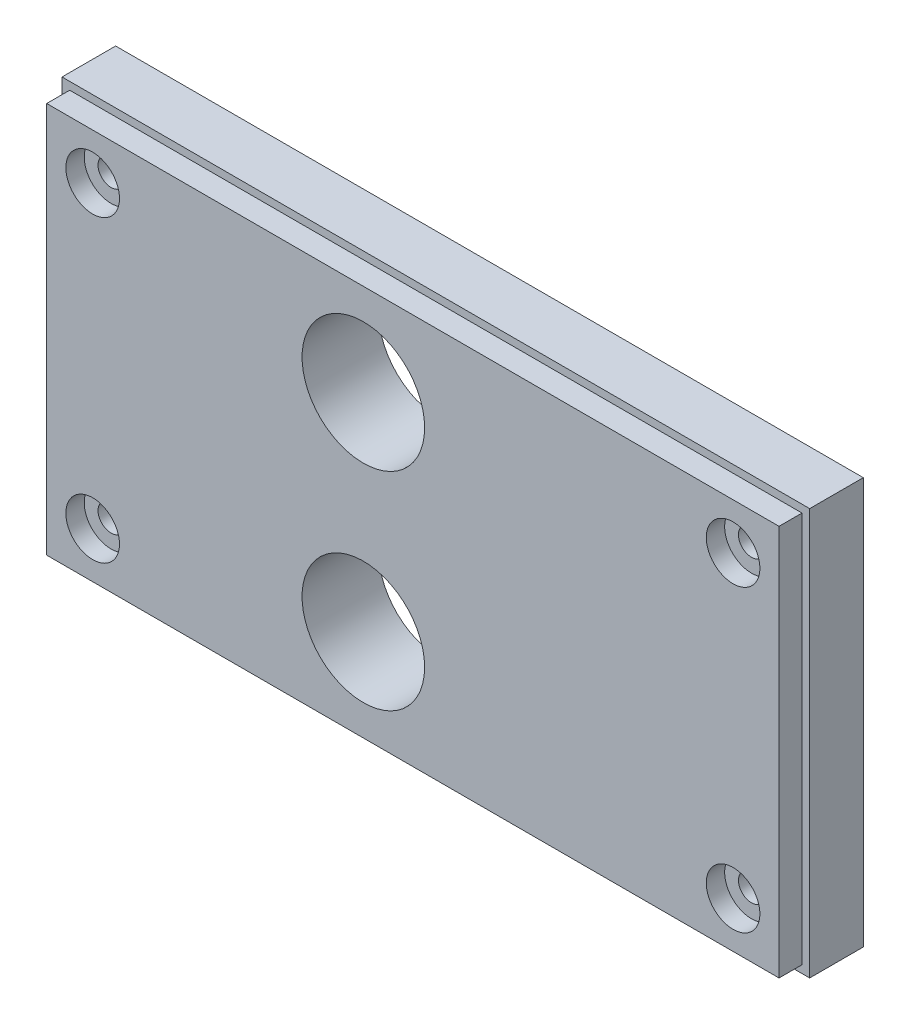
SolidWorks part; units mm, degrees
ref_plane "Płaszczyzna przednia" through (0, 0, 0) normal (0, 0, 1) x (1, 0, 0)
ref_plane "Płaszczyzna górna" through (0, 0, 0) normal (0, 1, 0) x (1, 0, 0)
ref_plane "Płaszczyzna prawa" through (0, 0, 0) normal (1, 0, 0) x (0, 0, -1)
sketch "Szkic1" plane through (0, 0, 0) normal (0, 0, 1) x (1, 0, 0)
  line L1 (130, -76.5359) -> (32.3904, -76.5359)
  line L2 (130, -76.5359) -> (130, -23.4641)
  line L3 (130, -23.4641) -> (32.3904, -23.4641)
  line L4 (32.3904, -76.5359) -> (32.3904, -23.4641)
  line L5 (130, -76.5359) -> (32.3904, -23.4641) construction
  line L6 (130, -23.4641) -> (32.3904, -76.5359) construction
  point P4 (81.1952, -50)
  dimension "D5" = 53.0718
extrude "Dodanie-wyciągnięcie1" add sketch "Szkic1" along normal blind 7
sketch "Szkic2" plane through (0, 0, 7) normal (0, 0, 1) x (1, 0, 0)
  line L0 (130, -23.4641) -> (32.3904, -23.4641) construction
  line L1 (33.3904, -24.4641) -> (129, -24.4641)
  line L2 (33.3904, -24.4641) -> (33.3904, -75.5359)
  line L3 (33.3904, -75.5359) -> (129, -75.5359)
  line L4 (129, -24.4641) -> (129, -75.5359)
  line L5 (33.3904, -24.4641) -> (129, -75.5359) construction
  line L6 (33.3904, -75.5359) -> (129, -24.4641) construction
  line L7 (32.3904, -23.4641) -> (32.3904, -76.5359) construction
  line L8 (32.3904, -76.5359) -> (130, -76.5359) construction
  line L9 (130, -76.5359) -> (130, -23.4641) construction
  point P4 (81.1952, -50)
  dimension "D1" = 1
  dimension "D2" = 1
  dimension "D3" = 1
  dimension "D4" = 1
extrude "Dodanie-wyciągnięcie2" add sketch "Szkic2" along normal blind 3
sketch "Szkic3" plane through (0, 0, 10) normal (0, 0, 1) x (1, 0, 0)
  line L0 (33.3904, -24.4641) -> (33.3904, -75.5359) construction
  line L1 (129, -24.4641) -> (33.3904, -24.4641) construction
  point P0 (39.3904, -30.4641)
  dimension "D1" = 6
  dimension "D2" = 6
hole_wizard "Pogłębienie walcowe pod M3 Śrubę z łbem stożkowym ściętym1" positions "Szkic 3D3" profile "Szkic4" counterbore size "M3" standard "ISO"
sketch3d "Szkic 3D3"
  point P0 (39.3904, -30.4641, 10)
sketch "Szkic4" plane through (39.3904, -30.4641, 10) normal (1, 0, 0) x (0, -1, 0)
  line L0 (0, 0) -> (0, 10.001)
  line L1 (0, 10.001) -> (1.7, 10.001)
  line L3 (1.7, 10.001) -> (1.7, 2.4)
  line L4 (1.7, 2.4) -> (3.5, 2.4)
  line L5 (3.5, 2.4) -> (3.5, 0)
  line L7 (3.5, 0) -> (0, 0)
  line L11 (0, -6.35) -> (0, 107.95) construction
  dimension "Średnica otworu na wylot" = 3.4
  dimension "Głębokość otworu na wylot" = 10.001
  dimension "Średnica pogłębienia walcowego" = 7
  dimension "Głębokość pogłębienia walcowego" = 2.4
ref_plane "Płaszczyzna1" through (0, -76.5359, 0) normal (0, -1, 0) x (-1, 0, 0)
ref_plane "Płaszczyzna2" through (0, -23.4641, 0) normal (0, 1, 0) x (1, 0, 0)
ref_plane "Płaszczyzna3" through (0, -50, 0) normal (0, 1, 0) x (1, 0, 0)
mirror "Lustro1" about plane through (0, -50, 0) normal (0, 1, 0) of "Pogłębienie walcowe pod M3 Śrubę z łbem stożkowym ściętym1"
ref_plane "Płaszczyzna4" through (130, 0, 0) normal (-1, 0, 0) x (0, 0, 1)
ref_plane "Płaszczyzna5" through (81.1952, 0, 0) normal (-1, 0, 0) x (0, 0, 1)
mirror "Lustro2" about plane through (81.1952, 0, 0) normal (-1, 0, 0) of "Lustro1", "Pogłębienie walcowe pod M3 Śrubę z łbem stożkowym ściętym1"
sketch "Szkic5" plane through (0, 0, 10) normal (0, 0, 1) x (1, 0, 0)
  line L0 (74.7286, -24.4641) -> (74.7286, -75.5359) construction
  line L1 (129, -24.4641) -> (33.3904, -24.4641) construction
  line L2 (33.3904, -75.5359) -> (129, -75.5359) construction
  circle A0 centre (74.7286, -36.4641) radius 8
  circle A1 centre (74.7286, -63.5359) radius 8
  dimension "D1" = 12
  dimension "D2" = 16
  dimension "D3" = 12
extrude "Wytnij-wyciągnięcie1" cut sketch "Szkic5" against normal up to next
